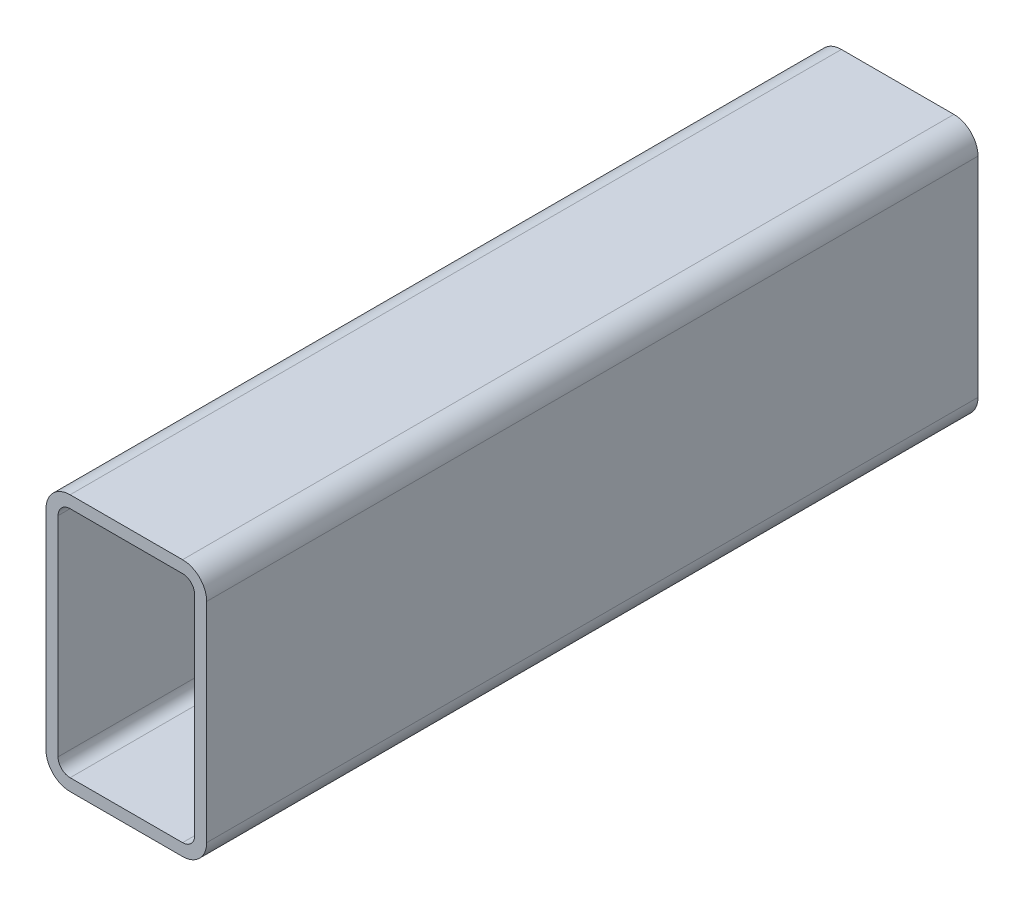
SolidWorks part; units mm, degrees
ref_plane "Front Plane" through (0, 0, 0) normal (0, 0, 1) x (1, 0, 0)
ref_plane "Top Plane" through (0, 0, 0) normal (0, 1, 0) x (1, 0, 0)
ref_plane "Right Plane" through (0, 0, 0) normal (1, 0, 0) x (0, 0, -1)
sketch "Sketch1" plane through (0, 0, 0) normal (0, 0, 1) x (1, 0, 0)
sketch_block_instance "HSS4x2.5x0.1875-1"
sketch_block "HSS4x2.5x0.1875"
extrude "Boss-Extrude1" add sketch "Sketch1" along normal blind 304.8
